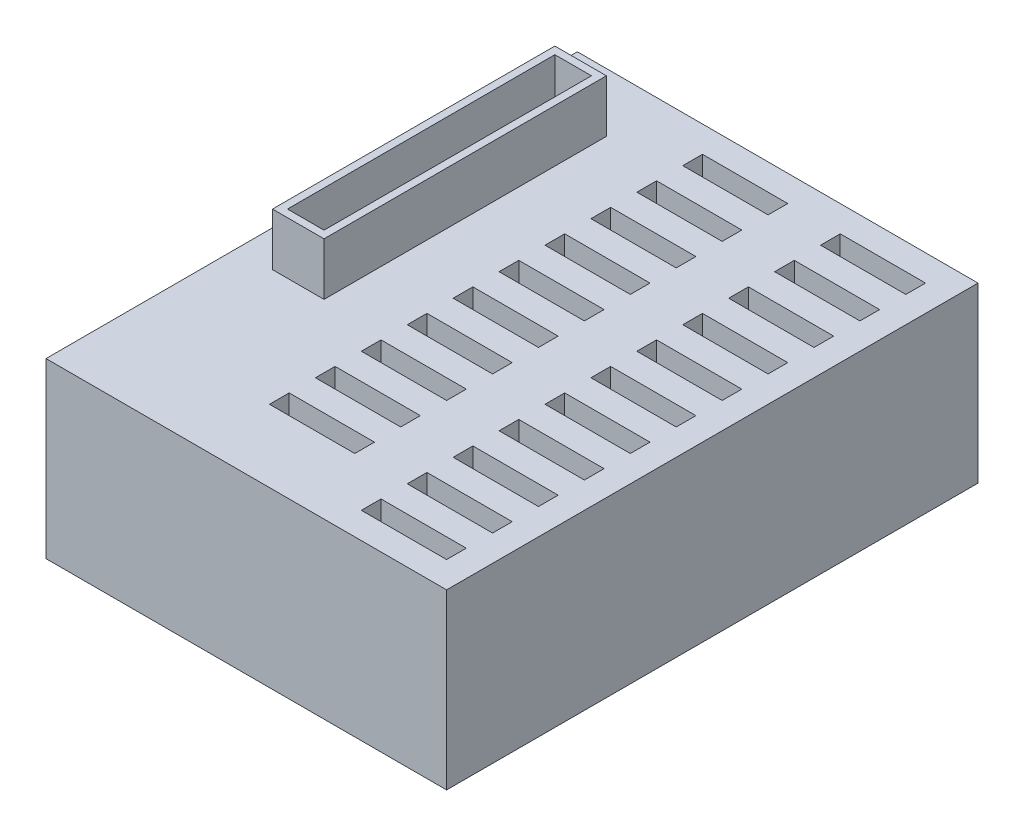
SolidWorks part; units mm, degrees
ref_plane "Front Plane" through (0, 0, 0) normal (0, 0, 1) x (1, 0, 0)
ref_plane "Top Plane" through (0, 0, 0) normal (0, 1, 0) x (1, 0, 0)
ref_plane "Right Plane" through (0, 0, 0) normal (1, 0, 0) x (0, 0, -1)
sketch "Sketch1" plane through (0, 0, 0) normal (0, 1, 0) x (1, 0, 0)
  line L1 (-105.7932, 79.5256) -> (44.2068, 79.5256)
  line L2 (-105.7932, 79.5256) -> (-105.7932, -131.9744)
  line L3 (-105.7932, -131.9744) -> (44.2068, -131.9744)
  line L4 (44.2068, 79.5256) -> (44.2068, -131.9744)
  dimension "D1" = 150
  dimension "D2" = 211.5
extrude "Boss-Extrude1" add sketch "Sketch1" against normal blind 66.04
sketch "Sketch3" plane through (0, 0, 0) normal (0, 1, 0) x (1, 0, 0)
  line L0 (44.2068, -131.9744) -> (44.2068, 79.5256) construction
  line L5 (-105.7932, -131.9744) -> (44.2068, -131.9744) construction
  line L6 (1.7068, -114.4744) -> (1.7068, -121.9744)
  line L7 (1.7068, -114.4744) -> (34.2068, -114.4744)
  line L8 (34.2068, -114.4744) -> (34.2068, -121.9744)
  line L9 (1.7068, -121.9744) -> (34.2068, -121.9744)
  line L98 (-50.7932, -96.9744) -> (-50.7932, -104.4744)
  line L99 (-50.7932, -104.4744) -> (-18.2932, -104.4744)
  line L100 (-18.2932, -96.9744) -> (-18.2932, -104.4744)
  line L101 (-50.7932, -96.9744) -> (-18.2932, -96.9744)
  line L102 (-50.7932, -79.4744) -> (-50.7932, -86.9744)
  line L103 (-50.7932, -86.9744) -> (-18.2932, -86.9744)
  line L104 (-18.2932, -79.4744) -> (-18.2932, -86.9744)
  line L105 (-50.7932, -79.4744) -> (-18.2932, -79.4744)
  line L106 (-50.7932, -61.9744) -> (-50.7932, -69.4744)
  line L107 (-50.7932, -69.4744) -> (-18.2932, -69.4744)
  line L108 (-18.2932, -61.9744) -> (-18.2932, -69.4744)
  line L109 (-50.7932, -61.9744) -> (-18.2932, -61.9744)
  line L110 (-50.7932, -44.4744) -> (-50.7932, -51.9744)
  line L111 (-50.7932, -51.9744) -> (-18.2932, -51.9744)
  line L112 (-18.2932, -44.4744) -> (-18.2932, -51.9744)
  line L113 (-50.7932, -44.4744) -> (-18.2932, -44.4744)
  line L114 (-50.7932, -26.9744) -> (-50.7932, -34.4744)
  line L115 (-50.7932, -34.4744) -> (-18.2932, -34.4744)
  line L116 (-18.2932, -26.9744) -> (-18.2932, -34.4744)
  line L117 (-50.7932, -26.9744) -> (-18.2932, -26.9744)
  line L118 (-50.7932, -9.4744) -> (-50.7932, -16.9744)
  line L119 (-50.7932, -16.9744) -> (-18.2932, -16.9744)
  line L120 (-18.2932, -9.4744) -> (-18.2932, -16.9744)
  line L121 (-50.7932, -9.4744) -> (-18.2932, -9.4744)
  line L122 (-50.7932, 8.0256) -> (-50.7932, 0.5256)
  line L123 (-50.7932, 0.5256) -> (-18.2932, 0.5256)
  line L124 (-18.2932, 8.0256) -> (-18.2932, 0.5256)
  line L125 (-50.7932, 8.0256) -> (-18.2932, 8.0256)
  line L126 (-50.7932, 25.5256) -> (-50.7932, 18.0256)
  line L127 (-50.7932, 18.0256) -> (-18.2932, 18.0256)
  line L128 (-18.2932, 25.5256) -> (-18.2932, 18.0256)
  line L129 (-50.7932, 25.5256) -> (-18.2932, 25.5256)
  line L130 (-50.7932, 43.0256) -> (-50.7932, 35.5256)
  line L131 (-50.7932, 35.5256) -> (-18.2932, 35.5256)
  line L132 (-18.2932, 43.0256) -> (-18.2932, 35.5256)
  line L133 (-50.7932, 43.0256) -> (-18.2932, 43.0256)
  line L134 (-50.7932, 60.5256) -> (-50.7932, 53.0256)
  line L135 (-50.7932, 53.0256) -> (-18.2932, 53.0256)
  line L136 (-18.2932, 60.5256) -> (-18.2932, 53.0256)
  line L137 (-50.7932, 60.5256) -> (-18.2932, 60.5256)
  line L138 (1.7068, -96.9744) -> (1.7068, -104.4744)
  line L139 (1.7068, -104.4744) -> (34.2068, -104.4744)
  line L140 (34.2068, -96.9744) -> (34.2068, -104.4744)
  line L141 (1.7068, -96.9744) -> (34.2068, -96.9744)
  line L142 (1.7068, -79.4744) -> (1.7068, -86.9744)
  line L143 (1.7068, -86.9744) -> (34.2068, -86.9744)
  line L144 (34.2068, -79.4744) -> (34.2068, -86.9744)
  line L145 (1.7068, -79.4744) -> (34.2068, -79.4744)
  line L146 (1.7068, -61.9744) -> (1.7068, -69.4744)
  line L147 (1.7068, -69.4744) -> (34.2068, -69.4744)
  line L148 (34.2068, -61.9744) -> (34.2068, -69.4744)
  line L149 (1.7068, -61.9744) -> (34.2068, -61.9744)
  line L150 (1.7068, -44.4744) -> (1.7068, -51.9744)
  line L151 (1.7068, -51.9744) -> (34.2068, -51.9744)
  line L152 (34.2068, -44.4744) -> (34.2068, -51.9744)
  line L153 (1.7068, -44.4744) -> (34.2068, -44.4744)
  line L154 (1.7068, -26.9744) -> (1.7068, -34.4744)
  line L155 (1.7068, -34.4744) -> (34.2068, -34.4744)
  line L156 (34.2068, -26.9744) -> (34.2068, -34.4744)
  line L157 (1.7068, -26.9744) -> (34.2068, -26.9744)
  line L158 (1.7068, -9.4744) -> (1.7068, -16.9744)
  line L159 (1.7068, -16.9744) -> (34.2068, -16.9744)
  line L160 (34.2068, -9.4744) -> (34.2068, -16.9744)
  line L161 (1.7068, -9.4744) -> (34.2068, -9.4744)
  line L162 (1.7068, 8.0256) -> (1.7068, 0.5256)
  line L163 (1.7068, 0.5256) -> (34.2068, 0.5256)
  line L164 (34.2068, 8.0256) -> (34.2068, 0.5256)
  line L165 (1.7068, 8.0256) -> (34.2068, 8.0256)
  line L166 (1.7068, 25.5256) -> (1.7068, 18.0256)
  line L167 (1.7068, 18.0256) -> (34.2068, 18.0256)
  line L168 (34.2068, 25.5256) -> (34.2068, 18.0256)
  line L169 (1.7068, 25.5256) -> (34.2068, 25.5256)
  line L170 (1.7068, 43.0256) -> (1.7068, 35.5256)
  line L171 (1.7068, 35.5256) -> (34.2068, 35.5256)
  line L172 (34.2068, 43.0256) -> (34.2068, 35.5256)
  line L173 (1.7068, 43.0256) -> (34.2068, 43.0256)
  line L174 (1.7068, 60.5256) -> (1.7068, 53.0256)
  line L175 (1.7068, 53.0256) -> (34.2068, 53.0256)
  line L176 (34.2068, 60.5256) -> (34.2068, 53.0256)
  line L177 (1.7068, 60.5256) -> (34.2068, 60.5256)
  line L179 (-53.7932, -121.9744) -> (-28.015, -121.9744)
  line L180 (-50.7932, -114.4744) -> (-18.2932, -114.4744)
  line L181 (-18.2932, -114.4744) -> (-18.2932, -121.9744)
  line L182 (-50.7932, -114.4744) -> (-50.7932, -121.9744)
  dimension "D1" = 7.5
  dimension "D2" = 10
  dimension "D3" = 10
  dimension "D4" = 32.5
  dimension "D7" = 20
  dimension "D8" = 10
  dimension "D5" = 2
  dimension "D6" = 11
extrude "Cut-Extrude1" cut sketch "Sketch3" against normal blind 10
sketch "Sketch9" plane through (-105.7932, 0, 0) normal (-1, 0, 0) x (0, 0, 1)
  line L1 (-79.5256, -66.04) -> (131.9744, -66.04)
  line L2 (-79.5256, -66.04) -> (-79.5256, 0)
  line L3 (-79.5256, 0) -> (131.9744, 0)
  line L4 (131.9744, -66.04) -> (131.9744, 0)
extrude "Boss-Extrude4" add sketch "Sketch9" along normal blind 2.667
sketch "Sketch10" plane through (0, 0, 0) normal (0, 1, 0) x (1, 0, 0)
  line L4 (44.2068, -131.9744) -> (44.2068, 79.5256) construction
  line L5 (-108.4602, 79.5256) -> (44.2068, 79.5256)
  line L6 (-108.4602, 79.5256) -> (-108.4602, 76.0256)
  line L7 (-108.4602, 76.0256) -> (44.2068, 76.0256)
  line L8 (44.2068, 79.5256) -> (44.2068, 76.0256)
  dimension "D1" = 3.5
extrude "Cut-Extrude3" cut sketch "Sketch10" against normal through all
sketch "Sketch11" plane through (0, -66.04, 0) normal (0, -1, 0) x (1, 0, 0)
  line L0 (-108.4602, 131.9744) -> (44.2068, 131.9744) construction
  line L1 (-103.4602, 126.9744) -> (39.2068, 126.9744)
  line L2 (-103.4602, 126.9744) -> (-103.4602, -71.0256)
  line L3 (-103.4602, -71.0256) -> (39.2068, -71.0256)
  line L4 (39.2068, 126.9744) -> (39.2068, -71.0256)
  line L5 (-108.4602, -76.0256) -> (44.2068, -76.0256) construction
  line L6 (-108.4602, -76.0256) -> (-108.4602, 131.9744) construction
  line L7 (44.2068, 131.9744) -> (44.2068, -76.0256) construction
  dimension "D1" = 5
  dimension "D2" = 5
  dimension "D3" = 5
  dimension "D4" = 5
extrude "Cut-Extrude4" cut sketch "Sketch11" against normal blind 48
sketch "Sketch13" plane through (0, 0, 0) normal (0, 1, 0) x (1, 0, 0)
  line L4 (44.2068, -131.9744) -> (44.2068, 76.0256) construction
  line L5 (-108.4602, 76.0256) -> (44.2068, 76.0256)
  line L6 (-108.4602, 76.0256) -> (-108.4602, 70.5256)
  line L7 (-108.4602, 70.5256) -> (44.2068, 70.5256)
  line L8 (44.2068, 76.0256) -> (44.2068, 70.5256)
  dimension "D1" = 5.5
extrude "Cut-Extrude6" cut sketch "Sketch13" against normal through all
sketch "Sketch15" plane through (0, -18.04, 0) normal (0, -1, 0) x (1, 0, 0)
  line L0 (39.2068, -70.5256) -> (39.2068, 126.9744) construction
  line L1 (-103.4602, -70.5256) -> (39.2068, -70.5256)
  line L2 (-103.4602, -70.5256) -> (-103.4602, -65.5256)
  line L3 (-103.4602, -65.5256) -> (39.2068, -65.5256)
  line L4 (39.2068, -70.5256) -> (39.2068, -65.5256)
  dimension "D1" = 5
extrude "Boss-Extrude6" add sketch "Sketch15" along normal blind 48
sketch "Sketch16" plane through (-108.4602, 0, 0) normal (-1, 0, 0) x (0, 0, 1)
  line L0 (131.9744, 0) -> (-70.5256, 0) construction
  line L3 (-70.5256, -66.04) -> (-70.5256, 0) construction
  circle A0 centre (-4.8756, -6) radius 1.35
  circle A1 centre (66.3244, -6) radius 1.35
  dimension "D1" = 2.7
  dimension "D2" = 2.7
  dimension "D3" = 6
  dimension "D5" = 71.2
  dimension "D6" = 65.65
  dimension "D4" = 6
extrude "Cut-Extrude7" cut sketch "Sketch16" against normal blind 10
sketch "Sketch17" plane through (0, 0, 0) normal (0, 1, 0) x (1, 0, 0)
  line L1 (-78.005, 45.1256) -> (-91.645, 45.1256)
  line L2 (-78.005, 45.1256) -> (-78.005, -56.4744)
  line L3 (-78.005, -56.4744) -> (-91.645, -56.4744)
  line L4 (-91.645, 45.1256) -> (-91.645, -56.4744)
  line L5 (-94.645, 48.1256) -> (-75.005, 48.1256)
  line L6 (-94.645, 48.1256) -> (-94.645, -59.4744)
  line L7 (-94.645, -59.4744) -> (-75.005, -59.4744)
  line L8 (-75.005, 48.1256) -> (-75.005, -59.4744)
  line L9 (-84.825, 45.1256) -> (-84.825, -56.4744) construction
  line L10 (-94.645, -5.6744) -> (-75.005, -5.6744) construction
  line L11 (-91.795, 45.2756) -> (-77.855, 45.2756)
  line L16 (-91.795, 45.2756) -> (-91.795, -56.6244)
  line L17 (-91.795, -56.6244) -> (-77.855, -56.6244)
  line L18 (-77.855, 45.2756) -> (-77.855, -56.6244)
  line L19 (-91.795, 45.2756) -> (-77.855, -56.6244) construction
  line L20 (-91.795, -56.6244) -> (-77.855, 45.2756) construction
  point P13 (-84.825, -5.6744)
  point P14 (-84.825, -5.6744)
  dimension "D1" = 13.64
  dimension "D2" = 101.6
  dimension "D3" = 3
  dimension "D4" = 3
  dimension "D5" = 3
  dimension "D6" = 3
  dimension "D7" = 0.15
  dimension "D8" = 0.15
extrude "Boss-Extrude7" add sketch "Sketch17" along normal blind 20 contours L8 L5 L6 L7 L11 L18 L17 L16
ref_plane "Plane1" through (44.2068, 0, 0) normal (1, 0, 0) x (0, 0, -1)
